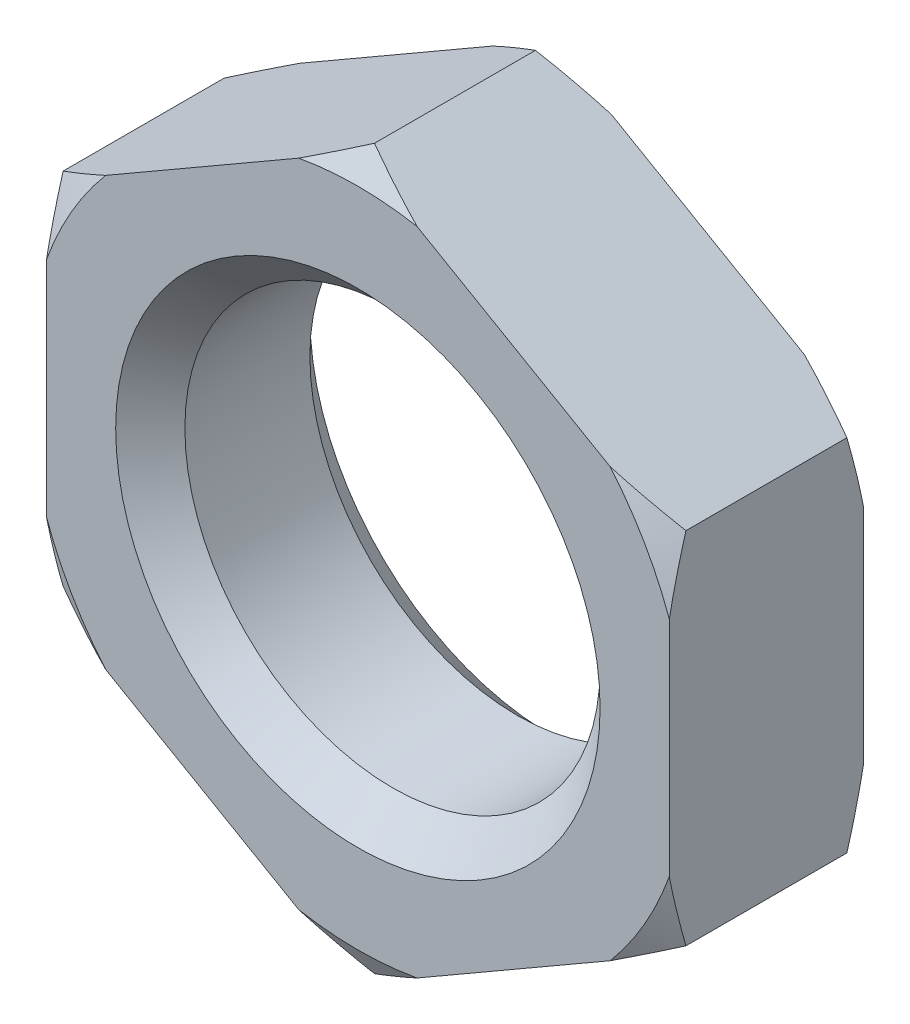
SolidWorks part; units mm, degrees
ref_plane "Front Plane" through (0, 0, 0) normal (0, 0, 1) x (1, 0, 0)
ref_plane "Top Plane" through (0, 0, 0) normal (0, 1, 0) x (1, 0, 0)
ref_plane "Right Plane" through (0, 0, 0) normal (1, 0, 0) x (0, 0, -1)
sketch "Sketch1" plane through (0, 0, 0) normal (0, 0, 1) x (1, 0, 0)
  line L1 (0, 15.5885) -> (-13.5, 7.7942)
  line L2 (-13.5, 7.7942) -> (-13.5, -7.7942)
  line L3 (-13.5, -7.7942) -> (0, -15.5885)
  line L4 (0, -15.5885) -> (13.5, -7.7942)
  line L5 (13.5, -7.7942) -> (13.5, 7.7942)
  line L6 (13.5, 7.7942) -> (0, 15.5885)
  circle A0 centre (0, 0) radius 13.5 construction
  circle A1 centre (0, 0) radius 9
  dimension "D2" = 18
  dimension "D1" = 27
extrude "Boss-Extrude1" add sketch "Sketch1" along normal mid plane 8.42
sketch "Sketch2" plane through (0, 0, 0) normal (1, 0, 0) x (0, 0, -1)
  line L0 (7.477, 0) -> (-8.5759, 0) construction
sketch "Sketch3" plane through (0, 0, 0) normal (1, 0, 0) x (0, 0, -1)
  line L0 (-4.21, 15.5885) -> (-4.21, 14.3385)
  line L1 (-4.21, 7.7942) -> (-4.21, 15.5885) construction
  line L2 (-4.21, 14.3385) -> (-3.4883, 15.5885)
  line L3 (-4.21, 15.5885) -> (4.21, 15.5885) construction
  line L4 (-3.4883, 15.5885) -> (-4.21, 15.5885)
  dimension "D1" = 1.25
  dimension "D2" = 30
revolve "Cut-Revolve1" cut sketch "Sketch3" angle 360 about L0
mirror "Mirror1" about plane through (0, 0, 0) normal (0, 0, 1) of "Cut-Revolve1"
chamfer "Chamfer1" distance 1.5 angle 45 2 edges at (9, 0, -4.21) (9, 0, 4.21)
